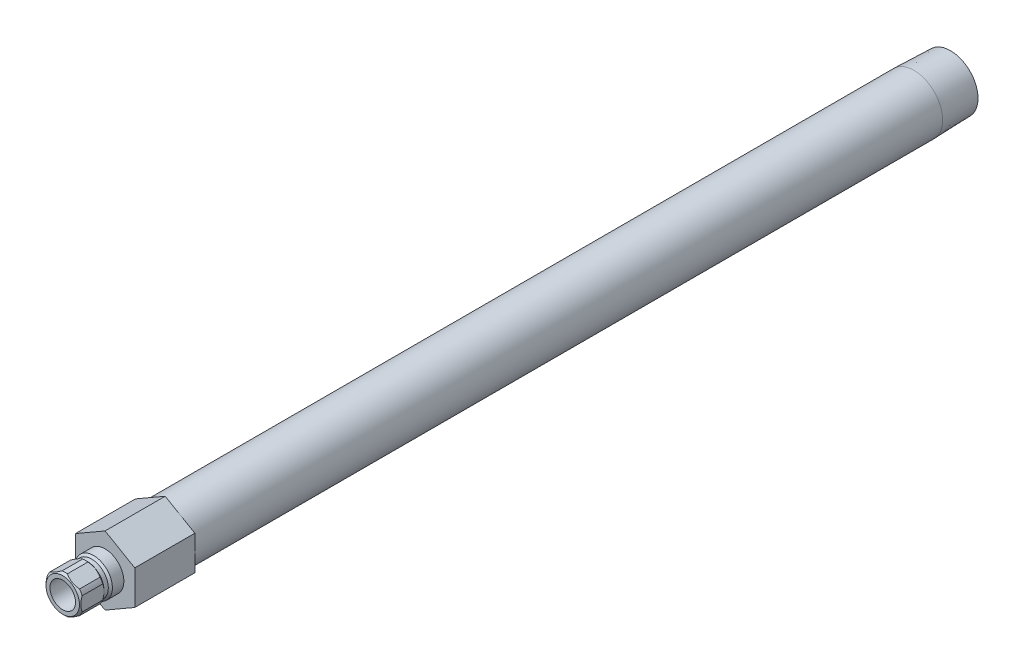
SolidWorks part; units mm, degrees
ref_plane "Front Plane" through (0, 0, 0) normal (0, 0, 1) x (1, 0, 0)
ref_plane "Top Plane" through (0, 0, 0) normal (0, 1, 0) x (1, 0, 0)
ref_plane "Right Plane" through (0, 0, 0) normal (1, 0, 0) x (0, 0, -1)
sketch "Sketch1" plane through (0, 0, 0) normal (1, 0, 0) x (0, 0, -1)
  line L0 (-13.1224, 0) -> (-18.923, 0) construction
  line L1 (-15.748, 4.7625) -> (-15.748, 6.223)
  line L2 (-6.604, 6.223) -> (-6.604, 0) construction
  line L3 (-14.986, 6.985) -> (-7.366, 6.985)
  line L5 (-6.604, 6.223) -> (-5.0165, 6.223)
  line L6 (-4.2545, 6.985) -> (0, 6.985)
  line L7 (0, 6.985) -> (0, 10.668)
  line L8 (-6.604, 6.223) -> (-7.366, 6.985)
  line L9 (-5.0165, 6.223) -> (-4.2545, 6.985)
  line L10 (-15.748, 6.223) -> (-14.986, 6.985)
  line L11 (-15.748, 4.7625) -> (22.352, 4.7625)
  line L12 (0, 10.668) -> (300.8884, 10.668)
  line L13 (300.8884, 10.668) -> (314.452, 10.2441)
  line L14 (314.452, 10.2441) -> (314.452, 7.8994)
  line L15 (0, 6.985) -> (22.352, 6.985) construction
  line L16 (22.352, 6.985) -> (22.352, 0) construction
  line L17 (22.352, 0) -> (-13.1224, 0) construction
  line L18 (22.352, 4.7625) -> (22.352, 7.8994)
  line L19 (22.352, 7.8994) -> (314.452, 7.8994)
  dimension "D1" = 15.748
  dimension "D2" = 1.5875
  dimension "D3" = 0.762
  dimension "D4" = 45
  dimension "D5" = 9.144
  dimension "D6" = 45
  dimension "D7" = 1.79
  dimension "D8" = 13.5636
  dimension "D9" = 330.2
  dimension "D10" = 3.175
  dimension "D11" = 9.525
  dimension "D12" = 21.336
  dimension "D13" = 38.1
  dimension "D14" = 13.97
  dimension "D15" = 15.7988
revolve "Revolve1" add sketch "Sketch1" angle 360 about L0
sketch "Sketch2" plane through (0, 0, 0) normal (0, 0, 1) x (1, 0, 0)
  line L1 (-11.049, 6.3791) -> (-11.049, -6.3791)
  line L2 (-11.049, -6.3791) -> (0, -12.7583)
  line L3 (0, -12.7583) -> (11.049, -6.3791)
  line L4 (11.049, -6.3791) -> (11.049, 6.3791)
  line L5 (11.049, 6.3791) -> (0, 12.7583)
  line L6 (0, 12.7583) -> (-11.049, 6.3791)
  circle A0 centre (0, 0) radius 11.049 construction
  circle A1 centre (0, 0) radius 4.7625 construction
  circle A2 centre (0, 0) radius 4.7625
  dimension "D1" = 22.098
extrude "Boss-Extrude1" add sketch "Sketch2" against normal up to vertex (22.352 mm away) from vertex at 0
sketch "Sketch3" plane through (0, 0, 0) normal (0, 0, 1) x (1, 0, 0)
  line L1 (6.477, -3.7395) -> (6.477, 3.7395)
  line L2 (6.477, 3.7395) -> (0, 7.479)
  line L3 (0, 7.479) -> (-6.477, 3.7395)
  line L4 (-6.477, 3.7395) -> (-6.477, -3.7395)
  line L5 (-6.477, -3.7395) -> (0, -7.479)
  line L6 (0, -7.479) -> (6.477, -3.7395)
  circle A0 centre (0, 0) radius 6.477 construction
  dimension "D1" = 12.954
extrude "Cut-Extrude1" cut sketch "Sketch3" along normal through all from vertex at 6.604 flip side to cut
